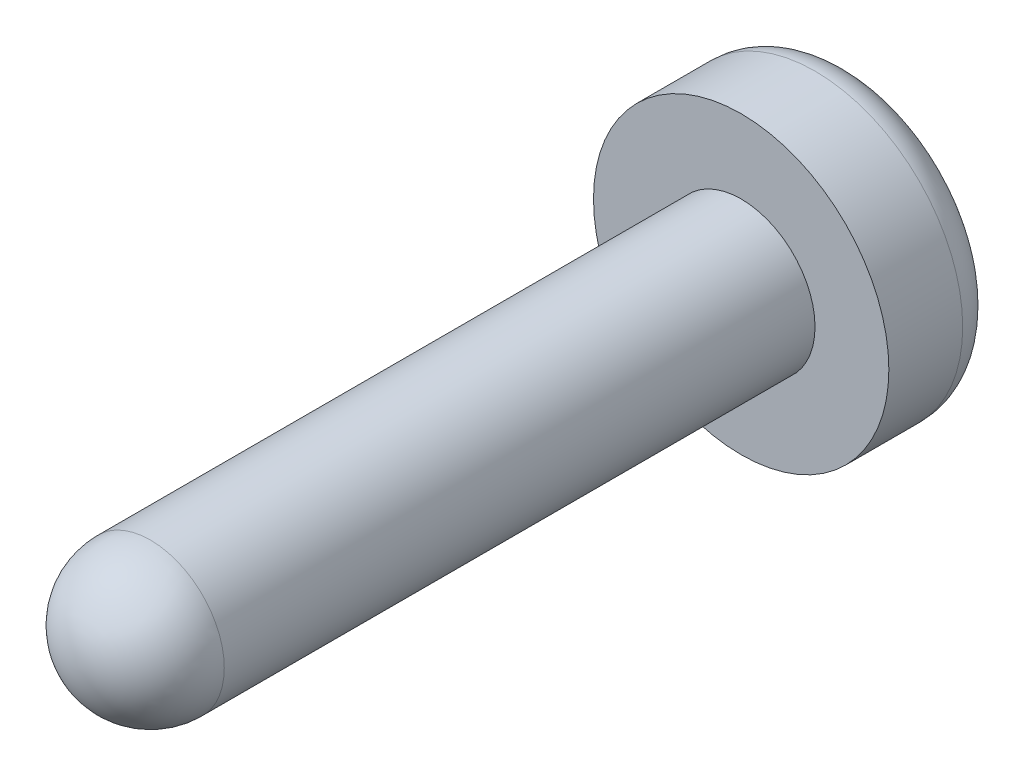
SolidWorks part; units mm, degrees
ref_plane "Спереди" through (0, 0, 0) normal (0, 0, 1) x (1, 0, 0)
ref_plane "Сверху" through (0, 0, 0) normal (0, 1, 0) x (1, 0, 0)
ref_plane "Справа" through (0, 0, 0) normal (1, 0, 0) x (0, 0, -1)
sketch "Skizze1" plane through (0, 0, 0) normal (0, 0, 1) x (1, 0, 0)
  circle A0 centre (0, 0) radius 2
  dimension "D1" = 4
extrude "Aufsatz-Linear austragen1" add sketch "Skizze1" along normal blind 1.5
sketch "Skizze2" plane through (0, 0, 1.5) normal (0, 0, 1) x (1, 0, 0)
  circle A0 centre (0, 0) radius 1
  dimension "D1" = 2
extrude "Aufsatz-Linear austragen2" add sketch "Skizze2" along normal blind 9
fillet "Verrundung1" radius 1 1 edges at (1, 0, 10.5)
fillet "Verrundung2" radius 0.5 1 edges at (2, 0, 0)
sketch "Skizze3" plane through (0, 0, 0) normal (0, 0, -1) x (-1, 0, 0)
  line L1 (-0.3165, 1.1432) -> (0.3157, 1.1432)
  line L2 (-0.3165, 1.1432) -> (-0.3165, -1.2165)
  line L3 (-0.3165, -1.2165) -> (0.3157, -1.2165)
  line L4 (0.3157, 1.1432) -> (0.3157, -1.2165)
  line L5 (-1.146, 0.2715) -> (1.1882, 0.2715)
  line L6 (-1.146, 0.2715) -> (-1.146, -0.358)
  line L7 (-1.146, -0.358) -> (1.1882, -0.358)
  line L8 (1.1882, 0.2715) -> (1.1882, -0.358)
extrude "Schnitt-Linear austragen1" cut sketch "Skizze3" against normal blind 0.5 contours L6 L7 L2 L5 | L2 L5 L4 L1 | L8 L5 L4 L7 | L7 L2 L3 L4 | L2 L7 L4 L5
